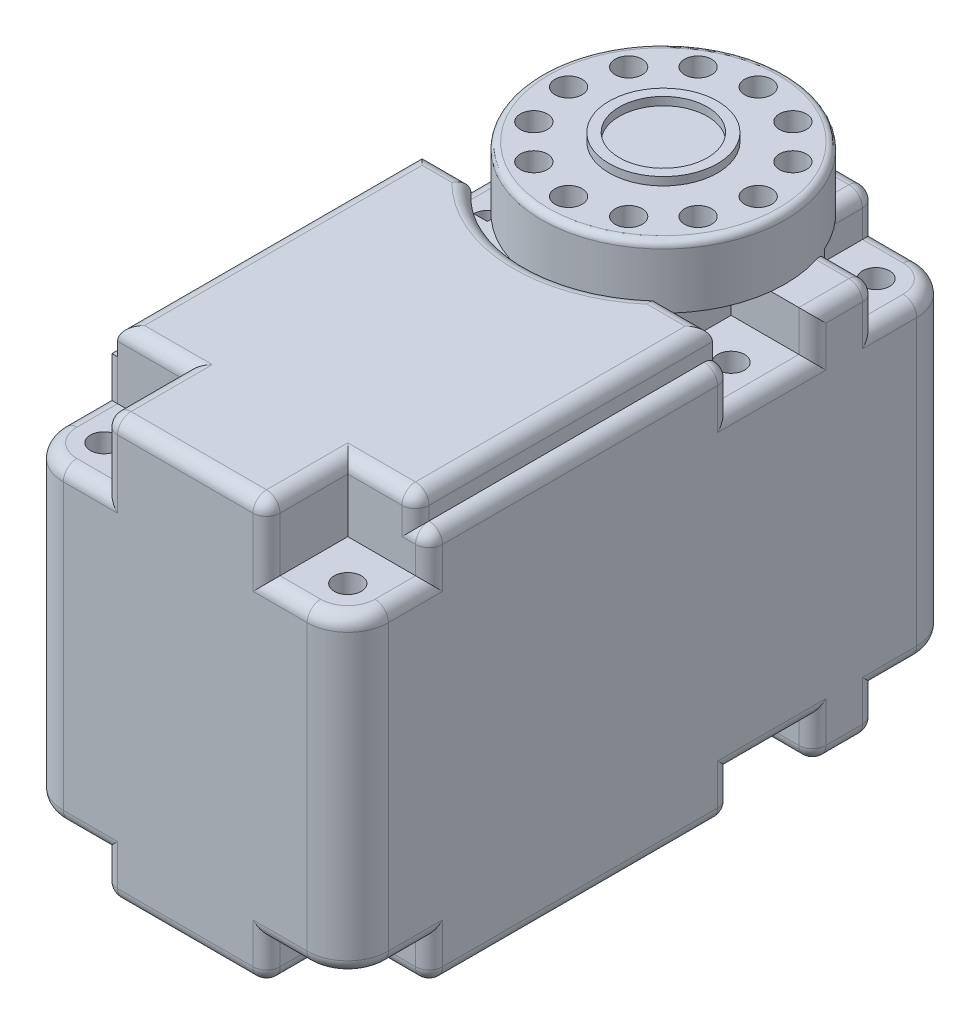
SolidWorks part; units mm, degrees
ref_plane "Front Plane" through (0, 0, 0) normal (0, 0, 1) x (1, 0, 0)
ref_plane "Top Plane" through (0, 0, 0) normal (0, 1, 0) x (1, 0, 0)
ref_plane "Right Plane" through (0, 0, 0) normal (1, 0, 0) x (0, 0, -1)
other "Center of Mass"
sketch "Sketch1" plane through (0, 0, 0) normal (0, 1, 0) x (1, 0, 0)
  line L1 (-12, -22.5) -> (12, -22.5)
  line L2 (-12, -22.5) -> (-12, 22.5)
  line L3 (-12, 22.5) -> (12, 22.5)
  line L4 (12, -22.5) -> (12, 22.5)
  line L5 (-12, -22.5) -> (12, 22.5) construction
  line L6 (-12, 22.5) -> (12, -22.5) construction
  point P0 (0, 0)
  dimension "D1" = 45
  dimension "D2" = 24
extrude "Boss-Extrude1" add sketch "Sketch1" along normal blind 31
sketch "Sketch2" plane through (0, 31, 0) normal (0, 1, 0) x (1, 0, 0)
  line L0 (12, 22.5) -> (-12, 22.5) construction
  circle A0 centre (0, 12.8) radius 9
  dimension "D2" = 18
  dimension "D1" = 9.7
extrude "Boss-Extrude2" add sketch "Sketch2" along normal blind 2.6
sketch "Sketch3" plane through (0, 31, 0) normal (0, 1, 0) x (1, 0, 0)
  line L0 (6.8117, 5.415) -> (11, 5.415)
  line L1 (11, 5.415) -> (11, -16.5)
  line L2 (11, -16.5) -> (6, -16.5)
  line L3 (6, -16.5) -> (6, -22.5)
  line L4 (-12, -22.5) -> (12, -22.5) construction
  line L5 (6, -22.5) -> (-6, -22.5)
  line L6 (-6, -22.5) -> (-6, -16.5)
  line L7 (-6, -16.5) -> (-11, -16.5)
  line L9 (-11, -16.5) -> (-11, 5.9883)
  line L10 (-11, 5.9883) -> (-7.385, 5.9883)
  line L11 (12, -22.5) -> (12, 22.5) construction
  line L12 (-12, 22.5) -> (-12, -22.5) construction
  line L17 (12, -22.5) -> (12, 22.5)
  line L18 (12, 22.5) -> (-12, 22.5)
  line L19 (-12, 22.5) -> (-12, -22.5)
  line L20 (-12, -22.5) -> (12, -22.5)
  line L21 (12, -22.5) -> (12, 22.5)
  line L22 (12, 22.5) -> (-12, 22.5)
  line L23 (-12, 22.5) -> (-12, -22.5)
  line L24 (-12, -22.5) -> (12, -22.5)
  arc A0 (-7.385, 5.9883) -> (6.8117, 5.415) centre (0, 12.8) ccw
  dimension "D1" = 6
  dimension "D2" = 6
  dimension "D3" = 6
  dimension "D4" = 6
  dimension "D5" = 1
  dimension "D6" = 1
  dimension "D7" = 0
extrude "Cut-Extrude1" cut sketch "Sketch3" against normal blind 2 contours L10 A0 L0 L1 L2 L3 L6 L7 L9 M15 M12 M13 M14 M11
sketch "Sketch4" plane through (0, 29, 0) normal (0, 1, 0) x (1, 0, 0)
  line L0 (-12, 22.5) -> (-12, -22.5) construction
  line L1 (12, 22.5) -> (6, 22.5)
  line L2 (12, 22.5) -> (12, 16.5)
  line L3 (12, 16.5) -> (6, 16.5)
  line L4 (6, 22.5) -> (6, 16.5)
  line L5 (-12, 22.5) -> (-6, 22.5)
  line L6 (-12, 22.5) -> (-12, 16.5)
  line L7 (-12, 16.5) -> (-6, 16.5)
  line L8 (-6, 22.5) -> (-6, 16.5)
  line L9 (12, -22.5) -> (12, 22.5) construction
  line L10 (-12, -22.5) -> (-6, -22.5)
  line L11 (-12, -22.5) -> (-12, -16.5)
  line L12 (-12, -16.5) -> (-6, -16.5)
  line L13 (-6, -22.5) -> (-6, -16.5)
  line L14 (12, -22.5) -> (6, -22.5)
  line L15 (12, -22.5) -> (12, -16.5)
  line L16 (12, -16.5) -> (6, -16.5)
  line L17 (6, -22.5) -> (6, -16.5)
  line L18 (12, 11.8) -> (6, 11.8)
  line L19 (12, 11.8) -> (12, 5.8)
  line L20 (12, 5.8) -> (6, 5.8)
  line L21 (6, 11.8) -> (6, 5.8)
  line L22 (12, 22.5) -> (-12, 22.5) construction
  line L23 (-12, 5.8) -> (-6, 5.8)
  line L24 (-12, 5.8) -> (-12, 11.8)
  line L25 (-12, 11.8) -> (-6, 11.8)
  line L26 (-6, 5.8) -> (-6, 11.8)
  circle A0 centre (-9, 19.5) radius 1
  circle A1 centre (9, 19.5) radius 1
  circle A2 centre (-9, 8.8) radius 1
  circle A3 centre (-9, -19.5) radius 1
  circle A4 centre (9, 8.8) radius 1
  circle A5 centre (9, -19.5) radius 1
  dimension "D17" = 2
  dimension "D18" = 2
  dimension "D19" = 2
  dimension "D20" = 2
  dimension "D21" = 2
  dimension "D22" = 2
  dimension "D1" = 6
  dimension "D2" = 6
  dimension "D3" = 6
  dimension "D4" = 6
  dimension "D5" = 4.7
  dimension "D6" = 6
  dimension "D7" = 6
  dimension "D8" = 6
  dimension "D9" = 6
  dimension "D10" = 6
  dimension "D11" = 6
  dimension "D12" = 3
  dimension "D13" = 3
  dimension "D14" = 3
  dimension "D15" = 3
  dimension "D16" = 3
extrude "Cut-Extrude2" cut sketch "Sketch4" against normal blind 3
sketch "Sketch5" plane through (0, 29, 0) normal (0, 1, 0) x (1, 0, 0)
  circle A0 centre (9, -19.5) radius 1 construction
  circle A1 centre (-9, -19.5) radius 1 construction
  arc A2 (-8.4165, 9.6121) -> (-8.0062, 8.6889) centre (0, 12.8) ccw construction
  arc A3 (-8.4165, 9.6121) -> (-8.0062, 8.6889) centre (-9, 8.8) ccw construction
  arc A4 (8.0062, 8.6889) -> (8.4165, 9.6121) centre (0, 12.8) ccw construction
  arc A5 (8.0062, 8.6889) -> (8.4165, 9.6121) centre (9, 8.8) ccw construction
  circle A6 centre (9, 19.5) radius 1 construction
  circle A7 centre (-9, 19.5) radius 1 construction
  circle A8 centre (9, -19.5) radius 1
  circle A9 centre (-9, -19.5) radius 1
  arc A10 (-8.4165, 9.6121) -> (-8.0062, 8.6889) centre (0, 12.8) ccw
  arc A11 (-8.4165, 9.6121) -> (-8.0062, 8.6889) centre (-9, 8.8) ccw
  arc A12 (8.0062, 8.6889) -> (8.4165, 9.6121) centre (0, 12.8) ccw
  arc A13 (8.0062, 8.6889) -> (8.4165, 9.6121) centre (9, 8.8) ccw
  circle A14 centre (9, 19.5) radius 1
  circle A15 centre (-9, 19.5) radius 1
  circle A16 centre (-9, 8.8) radius 1
  circle A17 centre (9, 8.8) radius 1
extrude "Cut-Extrude3" cut sketch "Sketch5" against normal through all contours A10 A11 | A14 | A10 A16 | A9 | A8 | A15 | A17
fillet "Fillet1" radius 3 4 edges at (-12, 13, 22.5) (12, 13, 22.5) (12, 13, -22.5) (-12, 13, -22.5)
fillet "Fillet2" radius 1 49 edges at (-6, 28.5, 22.5) (12, 27.5, 16.5) (-7.5, 26, 22.5) (12, 26, 18) (-11.1213, 26, 21.6213) (11.1213, 26, 21.6213) (-6, 27.5, -22.5) (6, 27.5, -22.5) (-6, 31, 19.5) (-12, 26, 18) (-12, 27.5, -16.5) (-12, 27.5, -11.8) (-12, 27.5, -5.8) (12, 27.5, -16.5) (12, 27.5, -11.8) (12, 27.5, -5.8) (7.5, 26, 22.5) (8.5, 31, 16.5) (-7.5, 26, -22.5) (-11.1213, 26, -21.6213) (7.5, 26, -22.5) (11.1213, 26, -21.6213) (-12, 27.5, 16.5) (-8.5, 31, 16.5) (0, 29, -22.5) (-0.4054, 31, -2.7614) (8.9058, 31, -5.415) (-9.1925, 31, -5.9883) (11, 31, 5.5425) (0, 31, 22.5) (-6, 29, -21.0041) (-12, 26, -18) (-10.1021, 29, -16.5) (-12, 29, -14.15) (-10.4721, 29, -11.8) (-12, 26, -8.8) (6, 29, -21.0041) (12, 26, -18) (10.1021, 29, -16.5) (12, 29, 5.35) (12, 29, -14.15) (9, 29, -5.8) (12, 26, -8.8) (11.5, 29, 16.5) (11, 30, 16.5) (6, 28.5, 22.5) (6, 31, 19.5) (-12, 29, 5.35) (-11, 31, 5.2558)
fillet "Fillet3" radius 0.5 1 edges at (0, 33.6, -3.8)
sketch "Sketch6" plane through (0, 0, 0) normal (0, -1, 0) x (1, 0, 0)
  line L1 (12, -16.5) -> (6, -16.5)
  line L2 (12, -16.5) -> (12, -22.5)
  line L3 (12, -22.5) -> (6, -22.5)
  line L4 (6, -16.5) -> (6, -22.5)
  line L5 (12, -16.5) -> (6, -22.5) construction
  line L6 (12, -22.5) -> (6, -16.5) construction
  line L7 (0, -28.2287) -> (0, 35.6703) construction
  line L9 (12, -5.8) -> (6, -5.8)
  line L10 (12, -5.8) -> (12, -11.8)
  line L11 (12, -11.8) -> (6, -11.8)
  line L12 (6, -5.8) -> (6, -11.8)
  line L13 (12, -5.8) -> (6, -11.8) construction
  line L14 (12, -11.8) -> (6, -5.8) construction
  line L15 (12, 22.5) -> (6, 22.5)
  line L16 (12, 22.5) -> (12, 16.5)
  line L17 (12, 16.5) -> (6, 16.5)
  line L18 (6, 22.5) -> (6, 16.5)
  line L19 (12, 22.5) -> (6, 16.5) construction
  line L20 (12, 16.5) -> (6, 22.5) construction
  circle A1 centre (0, -12.8) radius 8.5
  circle A2 centre (0, -12.8) radius 8.5 construction
  point P0 (9, -19.5)
  point P11 (9, -8.8)
  point P18 (9, 19.5)
  dimension "D2" = 6
  dimension "D3" = 6
  dimension "D4" = 6
  dimension "D5" = 6
  dimension "D6" = 6
  dimension "D7" = 6
  dimension "D1" = 0
extrude "Cut-Extrude4" cut sketch "Sketch6" against normal blind 3
ref_plane "Plane1" through (0, 0, 0) normal (1, 0, 0) x (0, 0, -1)
fillet "Fillet4" radius 1 20 edges at (12, 1.5, -5.8) (6, 1.5, 22.5) (12, 1.5, -16.5) (12, 1.5, 16.5) (12, 3, -8.8) (6, 1.5, -22.5) (7.5, 3, 22.5) (11.1213, 3, 21.6213) (12, 3, -18) (11.1213, 3, -21.6213) (9, 0, 16.5) (12, 3, 18) (6, 0, 19.5) (9, 0, -5.8) (12, 1.5, -11.8) (9, 0, -11.8) (6, 0, -8.8) (9, 0, -16.5) (7.5, 3, -22.5) (6, 0, -19.5)
fillet "Fillet5" radius 1 13 edges at (5.7071, 0.2929, 22.2071) (-2, 0, 22.5) (-12, 0, 0) (5.7071, 0.2929, -22.2071) (11.7071, 0.2929, 16.2071) (11.7071, 0.2929, -5.5071) (11.7071, 0.2929, -12.0929) (11.7071, 0.2929, -16.2071) (-2, 0, -22.5) (12, 0, 5.35) (12, 0, -14.15) (-11.1213, 0, 21.6213) (-11.1213, 0, -21.6213)
sketch "Sketch7" plane through (0, 0, 0) normal (0, -1, 0) x (1, 0, 0)
  circle A0 centre (0, -12.8) radius 8.5 construction
  circle A1 centre (0, -12.8) radius 8.5 construction
  circle A2 centre (0, -12.8) radius 3.2
  circle A3 centre (0, -12.8) radius 1.475
  dimension "D1" = 6.4
  dimension "D2" = 2.95
sketch "Sketch8" plane through (0, 26, 0) normal (0, 1, 0) x (1, 0, 0)
  circle A0 centre (9, 8.8) radius 1
  circle A1 centre (-9, 8.8) radius 1
extrude "Cut-Extrude7" cut sketch "Sketch7" against normal blind 0.5
sketch "Sketch9" plane through (0, 0, 0) normal (0, -1, 0) x (1, 0, 0)
  circle A1 centre (0, -12.8) radius 1.475
  circle A2 centre (0, -12.8) radius 1.475
  dimension "D1" = 0
extrude "Cut-Extrude8" cut sketch "Sketch9" against normal blind 10
sketch "Sketch10" plane through (0, 0, 0) normal (0, -1, 0) x (1, 0, 0)
  circle A0 centre (0, -12.8) radius 4.12
  circle A1 centre (0, -12.8) radius 3.2 construction
  circle A2 centre (0, -12.8) radius 3.2
  dimension "D1" = 8.24
extrude "Cut-Extrude9" cut sketch "Sketch10" against normal blind 0.8
fillet "Fillet6" radius 0.2 4 edges at (0, 0.5, -14.275) (0, 0.5, -16) (0, 0.8, -16.92) (0, 0, -16.92)
sketch "Sketch11" plane through (0, 33.6, 0) normal (0, 1, 0) x (1, 0, 0)
  circle A0 centre (0, 12.8) radius 7 construction
  circle A1 centre (0, 19.8) radius 1
  circle A2 centre (3.5, 18.8622) radius 1
  circle A3 centre (6.0622, 16.3) radius 1
  circle A4 centre (7, 12.8) radius 1
  circle A5 centre (6.0622, 9.3) radius 1
  circle A6 centre (3.5, 6.7378) radius 1
  circle A7 centre (0, 5.8) radius 1
  circle A8 centre (-3.5, 6.7378) radius 1
  circle A9 centre (-6.0622, 9.3) radius 1
  circle A10 centre (-7, 12.8) radius 1
  circle A11 centre (-6.0622, 16.3) radius 1
  circle A12 centre (-3.5, 18.8622) radius 1
  point P29 (0, 12.8)
  dimension "D1" = 12
extrude "Cut-Extrude11" cut sketch "Sketch11" against normal blind 3.5
sketch "Sketch12" plane through (0, 33.6, 0) normal (0, 1, 0) x (1, 0, 0)
  circle A0 centre (0, 12.8) radius 3.25
  circle A1 centre (0, 12.8) radius 4
  dimension "D1" = 8
extrude "Boss-Extrude3" add sketch "Sketch12" along normal blind 0.6
mirror "Mirror3" about plane through (0, 0, 0) normal (1, 0, 0) of "Cut-Extrude4"
fillet "Fillet7" radius 1 26 edges at (-8.5, 0, 16.5) (-8.5, 0, -5.8) (-8.5, 0, -16.5) (-6, 0, -19) (-11.7071, 0.2929, 16.5) (-11.7071, 0.2929, -5.8) (-11.7071, 0.2929, -16.5) (-6, 0.2929, -22.2071) (-12, 2, 16.5) (-12, 2, -5.8) (-12, 2, -16.5) (-6, 2, -22.5) (-7.5, 3, 22.5) (-12, 3, 18) (-6, 2, 22.5) (-6, 0.2929, 22.2071) (-8.5, 0, -11.8) (-12, 2, -11.8) (-11.1213, 3, 21.6213) (-6, 0, 19) (-6, 0, -8.8) (-11.7071, 0.2929, -11.8) (-12, 3, -8.8) (-12, 3, -18) (-11.1213, 3, -21.6213) (-7.5, 3, -22.5)
sketch "Sketch13" plane through (0, 31, 0) normal (0, 1, 0) x (1, 0, 0)
  line L0 (-6, 16.5) -> (-6, 22.5)
  line L1 (-11, 16.5) -> (-6, 16.5) construction
  line L2 (-9, 22.5) -> (-5, 22.5) construction
  line L3 (-6, 16.5) -> (-12, 16.5)
  line L4 (-12, 15.5) -> (-12, 19.5) construction
  line L5 (-6, 16.5) -> (-6, 21.5) construction
  line L6 (-6, 5.8) -> (-12, 5.8)
  line L7 (-12, 4.8) -> (-12, 12.8) construction
  line L8 (-6, 5.8) -> (-6, 11.8)
  line L9 (-6, 5.8) -> (-6, 11.8) construction
  line L10 (-6, 11.8) -> (-12, 11.8)
  line L11 (15, 22.5) -> (15, -22.5)
  line L12 (17, -22.5) -> (17, -27)
  line L13 (-6, 11.8) -> (-11, 11.8) construction
  line L14 (-12, 16.5) -> (-12, 11.8)
  line L15 (-6, 22.5) -> (-12, 22.5)
  line L16 (-6, -16.5) -> (-12, -16.5)
  line L17 (-12, -19.5) -> (-12, -15.5) construction
  line L18 (-6, -16.5) -> (-6, -22.5)
  line L19 (-5, -22.5) -> (-9, -22.5) construction
  line L20 (-6, -22.5) -> (-12, -22.5)
  line L21 (0, -14.85) -> (0, 14.85) construction
  line L22 (-12, -22.5) -> (-17, -22.5)
  line L23 (-12, -22.5) -> (-12, 22.5)
  line L24 (-12, 22.5) -> (-17, 22.5)
  line L25 (-17, -22.5) -> (-17, 22.5)
  line L26 (-17, -22.5) -> (17, -22.5)
  line L27 (-17, -22.5) -> (-17, -27)
  line L28 (-17, -27) -> (17, -27)
  line L29 (0, -22.5) -> (0, -27)
  line L30 (-15, 22.5) -> (-15, -22.5)
  line L31 (-12, -15.5) -> (-12, 4.8) construction
  line L32 (17, -22.5) -> (17, 22.5)
  line L33 (12, 22.5) -> (17, 22.5)
  line L34 (12, -22.5) -> (12, 22.5)
  line L35 (12, -22.5) -> (17, -22.5)
  line L36 (6, -22.5) -> (12, -22.5)
  line L37 (6, -16.5) -> (6, -22.5)
  line L38 (6, -16.5) -> (12, -16.5)
  line L39 (6, 22.5) -> (12, 22.5)
  line L40 (12, 16.5) -> (12, 11.8)
  line L41 (6, 11.8) -> (12, 11.8)
  line L42 (6, 5.8) -> (6, 11.8)
  line L43 (6, 5.8) -> (12, 5.8)
  line L44 (6, 16.5) -> (12, 16.5)
  line L45 (6, 16.5) -> (6, 22.5)
  circle A0 centre (-9, 19.5) radius 1
  circle A1 centre (-9, 8.8) radius 1
  circle A2 centre (-9, -19.5) radius 1
  circle A3 centre (-9, -19.5) radius 1 construction
  circle A4 centre (-15, -18.5) radius 1.35
  circle A5 centre (-15, -1.5) radius 1.35
  circle A6 centre (-8.5, -24.8) radius 1.35
  circle A7 centre (8.5, -24.8) radius 1.35
  circle A8 centre (15, -1.5) radius 1.35
  circle A9 centre (15, -18.5) radius 1.35
  circle A10 centre (9, -19.5) radius 1
  circle A11 centre (9, 8.8) radius 1
  circle A12 centre (9, 19.5) radius 1
  dimension "D3" = 2.7
  dimension "D1" = 5
  dimension "D2" = 3
  dimension "D4" = 4
  dimension "D5" = 17
  dimension "D6" = 4.5
  dimension "D7" = 3.5
  dimension "D8" = 2.3
extrude "Boss-Extrude4" [suppressed] add sketch "Sketch13" against normal up to surface (5 mm away) contours A5 L30 A4 L22 L23 L14 L24 | A5 L30 L24 L25 L26 A4 | L23 L6 L8 L10 A1 | L23 L3 L0 L15 A0 | L45 L44 L34 L39 A12 | L42 L43 L34 L41 A11 | L11 A9 A8 L33 L34 L26 | L11 A9 L26 L32 L33 A8 | L26 L29 L28 L12 A7 | L38 L37 L26 L34 A10 | L23 L20 L18 L16 A2 | L29 L26 L20 L22 L27 L28 A6
